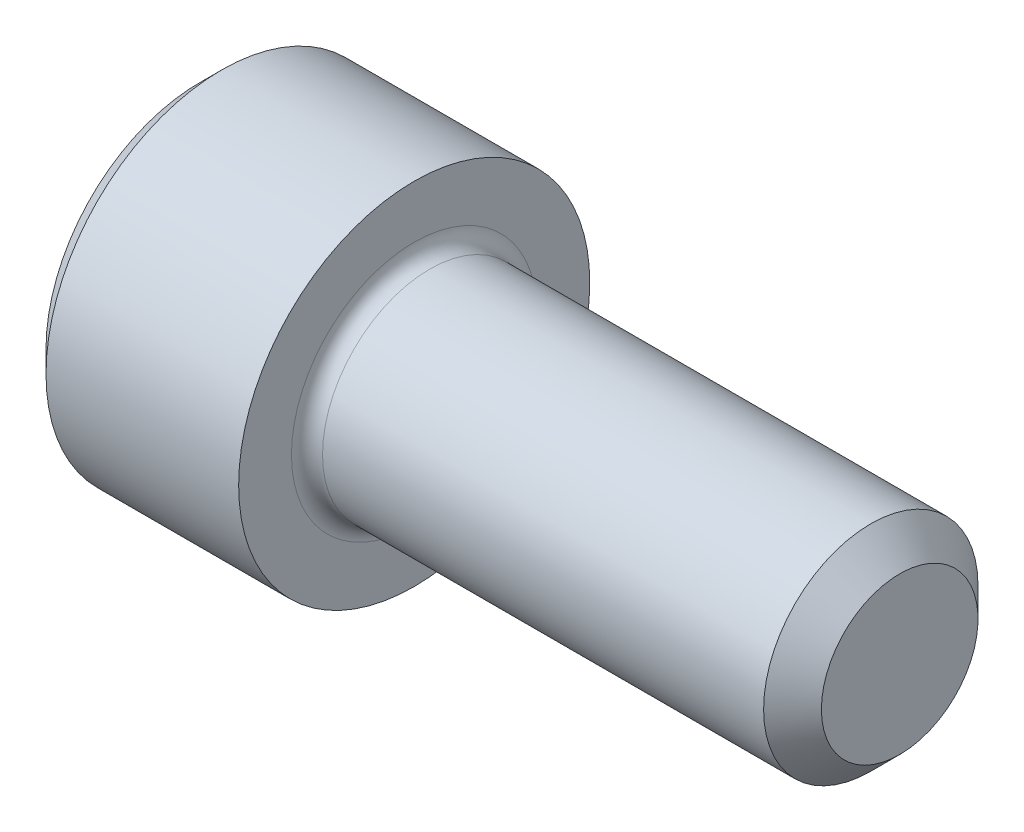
SolidWorks part; units mm, degrees
ref_plane "Plane1" through (0, 0, 0) normal (0, 0, 1) x (1, 0, 0)
ref_plane "Plane2" through (0, 0, 0) normal (0, 1, 0) x (1, 0, 0)
ref_plane "Plane3" through (0, 0, 0) normal (1, 0, 0) x (0, 0, -1)
revolve "Base-Revolve" add sketch "BodySke"
sketch "BodySke" plane through (0, 0, 0) normal (0, 0, 1) x (1, 0, 0)
  line L0 (0, 0) -> (0, 2.5146)
  line L1 (0.3556, 2.8702) -> (3.5052, 2.8702)
  line L2 (3.5052, 2.8702) -> (3.5052, 1.7526)
  line L3 (3.5052, 1.7526) -> (10.9703, 1.7526)
  line L4 (11.4427, 1.2802) -> (11.4427, 0)
  line L5 (11.4427, 0) -> (0, 0)
  line L6 (-31.75, 0) -> (127, 0) construction
  line L7 (0, 2.5146) -> (0.3556, 2.8702)
  line L8 (11.4427, 1.2802) -> (10.9703, 1.7526)
  line L9 (0, -2.5146) -> (0.3556, -2.8702) construction
  line L10 (11.4427, -1.2802) -> (10.9703, -1.7526) construction
  line L11 (4.2977, 9.525) -> (4.2977, 3.175) construction
  line L12 (3.5052, 9.525) -> (3.5052, 3.175) construction
  line L13 (-26.6573, 9.525) -> (-26.6573, 3.175) construction
  dimension "Diameter" = 3.5052
  dimension "Head_ht" = 3.5052
  dimension "Length" = 7.9375
  dimension "Body_ch_ang" = 45
  dimension "Head_dia" = 5.7404
  dimension "Head_ch_ang" = 45
  dimension "Head_side_ht" = 3.1496
  dimension "Minor_dia" = 2.5603
  dimension "Advance" = 0.7925
  dimension "Thread_nom" = 7.9375
  dimension "Thread_length" = 38.1
fillet "Fillet1" radius 0.254 1 edges at (3.5052, 0, 1.7526)
sketch "Sketch2" plane through (0, 0, 0) normal (0, 0, 1) x (1, 0, 0)
  line L0 (0, 1.3843) -> (1.6256, 1.3843)
  line L1 (1.6256, 1.3843) -> (2.4248, 0)
  line L2 (-31.75, 0) -> (127, 0) construction
  line L3 (2.4248, 0) -> (0, 0)
  line L4 (0, 0) -> (0, 1.3843)
  line L5 (0, 2.5146) -> (0, -2.5146) construction
  line L6 (0, 0) -> (47.625, 0) construction
  line L7 (3.5052, -2.8702) -> (3.5052, 2.8702) construction
  dimension "D1" = 1.3843
  dimension "D2" = 60
  dimension "Wall_thickness" = 1.8796
revolve "Hex-PreBroach" cut sketch "Sketch2" angle 360 about L6
sketch "Sketch3" plane through (0, 0, 0) normal (-1, 0, 0) x (0, 0.5, 0.866)
  line L0 (0.7992, 1.3843) -> (-0.7992, 1.3843)
  line L1 (-0.7992, 1.3843) -> (-1.5985, 0)
  line L2 (0.7992, 1.3843) -> (1.5985, 0)
  line L3 (0.7992, -1.3843) -> (1.5985, 0)
  line L4 (0.7992, -1.3843) -> (-0.7992, -1.3843)
  line L5 (-0.7992, -1.3843) -> (-1.5985, 0)
  dimension "D1" = 1.3843
  dimension "D2" = 1.3843
  dimension "Hex_size" = 2.7686
extrude "Hex" cut sketch "Sketch3" against normal blind 1.6256
sketch "Sketch4" plane through (0, 0, 0) normal (-1, 0, 0) x (0, 0, 1)
  line L0 (0, 0) -> (1.7399, 0)
  line L1 (0, 0) -> (6.1484, 3.5498) construction
  line L2 (0, 0) -> (0.8699, 1.5068)
  line L3 (1.4457, 0.3947) -> (1.6607, 0.5189)
  line L4 (1.0647, 1.0546) -> (1.2797, 1.1788)
  arc A0 (1.4457, 0.3947) -> (1.0647, 1.0546) centre (0, 0) ccw
  arc A1 (1.7399, 0) -> (1.6607, 0.5189) centre (0, 0) ccw
  arc A2 (0.8699, 1.5068) -> (1.2797, 1.1788) centre (0, 0) cw
  dimension "D1" = 30
  dimension "Spline_n_dim" = 2.9972
  dimension "Spline_m_dim" = 3.4798
  dimension "D2" = 60
  dimension "D3" = 0.381
  dimension "Spline_p_dim" = 0.762
extrude "Spline" [suppressed] cut sketch "Sketch4" against normal blind 1.6256
pattern_circular "CirPattern1" [suppressed] count 6 every 60
sketch "Sketch5" plane through (0, 0, 0) normal (0, 0, 1) x (1, 0, 0)
  line L0 (-31.75, 0) -> (127, 0) construction
  line L2 (0, 2.5146) -> (0, -2.5146) construction
  circle A0 centre (1.27, 0) radius 0.4445
  dimension "Drilled_hole_dia" = 0.889
  dimension "Drilled_hole_loc" = 1.27
extrude "Hole" [suppressed] cut sketch "Sketch5" against normal through all and the other way through all
pattern_circular "Drilled-4" [suppressed] count 2 every 60
pattern_circular "Drilled-6" [suppressed] count 3 every 60
sketch "ThdSchSke" plane through (0, 0, 0) normal (0, 0, 1) x (1, 0, 0)
  line L0 (4.2977, -1.2802) -> (3.9669, -1.7526)
  line L1 (4.2977, -1.2802) -> (4.6285, -1.7526)
  line L2 (4.6285, -1.7526) -> (4.6285, -2.1908)
  line L3 (-3.175, 0) -> (5.1513, 0) construction
  line L5 (4.6285, -2.1908) -> (3.9669, -2.1908)
  line L6 (3.9669, -2.1908) -> (3.9669, -1.7526)
  line L7 (0, 2.5146) -> (0, -2.5146) construction
  dimension "Thread_minor" = 2.5603
  dimension "Diameter" = 3.5052
  dimension "Start" = 4.2977
  dimension "SideAngle" = 55
  dimension "VeeAngle" = 70
  dimension "Overcut" = 4.3815
revolve "ThreadSchematic" [suppressed] cut sketch "ThdSchSke" angle 360 about L3
pattern_linear "ThdSchPat" [suppressed]
equation "\"D2@Sketch3\" = \"Hex_size@Sketch3\" / 2"
equation "\"D1@Sketch3\" = \"Hex_size@Sketch3\" / 2"
equation "\"D1@Sketch2\" = \"Hex_size@Sketch3\" / 2"
equation "\"D3@Sketch4\" = \"Spline_p_dim@Sketch4\" / 2"
equation "\"Thread_minor@ThreadCosmetic\"  =  \"Minor_dia@BodySke\""
equation "\"D2@CirPattern1\" = 360 / \"Num_teeth@CirPattern1\""
equation "\"Wall_thickness@Sketch2\" = \"Head_ht@BodySke\" - \"Key_eng@Hex\""
equation "\"Thread_length@ThreadCosmetic\" = ((sgn( (\"Length@BodySke\" - \"Advance@BodySke\" ) - \"Thread_nom@BodySke\" )-1)*( (\"Length@BodySke\" - \"Advance@BodySke\" ) - \"Thread_nom@BodySke\" ))/-2+ \"Thread_nom@BodySke\""
equation "\"Thread_minor@ThdSchSke\" = \"Minor_dia@BodySke\""
equation "\"Diameter@ThdSchSke\" = \"Diameter@BodySke\""
equation "\"Overcut@ThdSchSke\" = \"Diameter@BodySke\" * 1.25"
equation "\"Start@ThdSchSke\" = \"Head_ht@BodySke\" + \"Length@BodySke\" - \"Thread_length@ThreadCosmetic\"  '---Non-countersunk---"
equation "\"Num_threads@ThdSchPat\" = int( \"Thread_length@ThreadCosmetic\" / \"Advance@BodySke\" + 0.999 )  + 1"
equation "\"Advance@ThdSchPat\" = \"Thread_length@ThreadCosmetic\" /  (\"Num_threads@ThdSchPat\" - 1) 'relax it"
equation "\"Num_threads@ThdSchPat\" = \"Num_threads@ThdSchPat\" - sgn( \"Num_threads@ThdSchPat\" - 1) '---chamfered tips only---"
